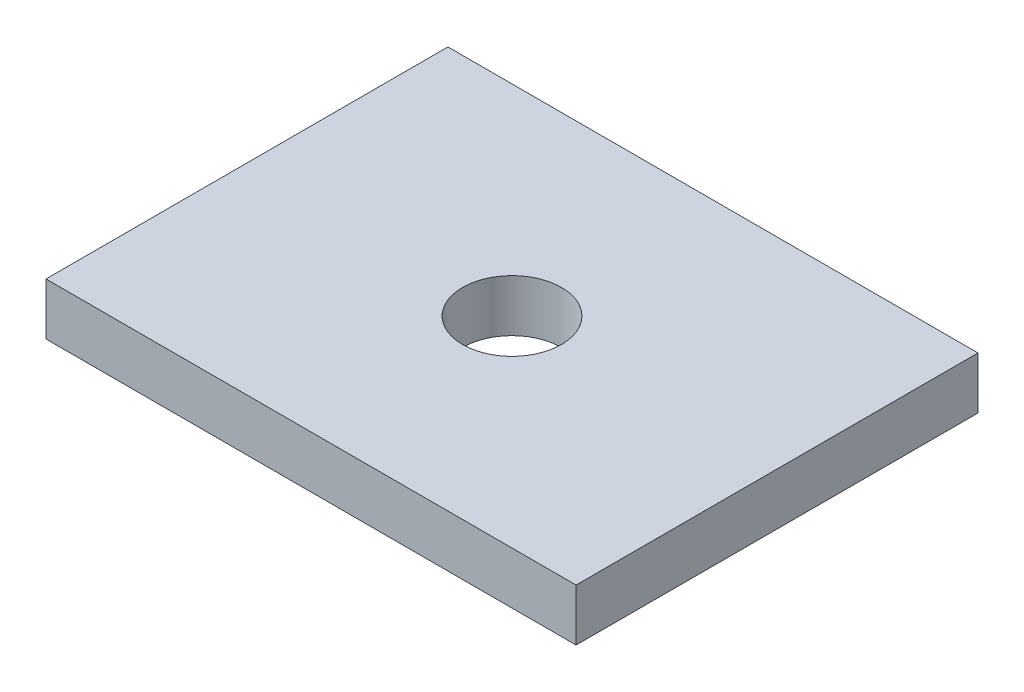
SolidWorks part; units mm, degrees
ref_plane "Ebene vorne" through (0, 0, 0) normal (0, 0, 1) x (1, 0, 0)
ref_plane "Ebene oben" through (0, 0, 0) normal (0, 1, 0) x (1, 0, 0)
ref_plane "Ebene rechts" through (0, 0, 0) normal (1, 0, 0) x (0, 0, -1)
sketch "Skizze1" plane through (0, 0, 0) normal (0, 1, 0) x (1, 0, 0)
  line L1 (-50.9722, 38.6478) -> (50.9722, 38.6478)
  line L2 (-50.9722, 38.6478) -> (-50.9722, -38.6478)
  line L3 (-50.9722, -38.6478) -> (50.9722, -38.6478)
  line L4 (50.9722, 38.6478) -> (50.9722, -38.6478)
  line L5 (-50.9722, 38.6478) -> (50.9722, -38.6478) construction
  line L6 (-50.9722, -38.6478) -> (50.9722, 38.6478) construction
  point P0 (0, 0)
extrude "Linear austragen1" add sketch "Skizze1" along normal blind 10
sketch "Skizze2" plane through (0, 10, 0) normal (0, 1, 0) x (1, 0, 0)
  circle A0 centre (0, 0) radius 9.5128
extrude "Linear austragen2" cut sketch "Skizze2" against normal blind 10
